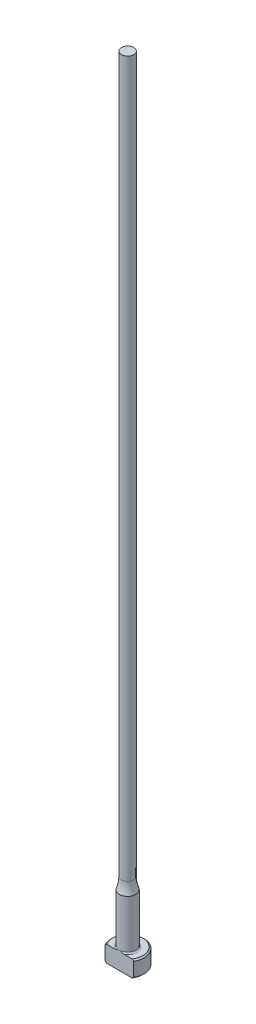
SolidWorks part; units mm, degrees
ref_plane "Front Plane" through (0, 0, 0) normal (0, 0, 1) x (1, 0, 0)
ref_plane "Top Plane" through (0, 0, 0) normal (0, 1, 0) x (1, 0, 0)
ref_plane "Right Plane" through (0, 0, 0) normal (1, 0, 0) x (0, 0, -1)
sketch "Sketch1" plane through (0, 0, 0) normal (0, 0, 1) x (1, 0, 0)
  line L0 (0, 259.9588) -> (0, -15.1925) construction
  line L1 (0, 0) -> (-3.175, 0)
  line L2 (-3.175, 0) -> (-3.175, 3.175)
  line L3 (-3.175, 3.175) -> (-1.5875, 3.175)
  line L4 (-1.19, 14.9114) -> (-1.19, 152.4)
  line L5 (-1.19, 152.4) -> (0, 152.4)
  line L6 (0, 152.4) -> (0, 0)
  line L7 (-1.5875, 3.175) -> (-1.5875, 12.7)
  arc A0 (-1.5875, 12.7) -> (-1.19, 14.9114) centre (-7.54, 14.9114) ccw
  point P13 (-1.5875, 0)
  dimension "D1" = 6.35
  dimension "L" = 152.4
  dimension "D2" = 3.175
  dimension "H" = 6.35
  dimension "T" = 3.175
  dimension "D" = 2.38
  dimension "S" = 12.7
revolve "Revolve1" add sketch "Sketch1" angle 360 about L0
chamfer "Chamfer1" distance 0.254 angle 45 2 edges at (0, 3.175, 3.175) (0, 0, 3.175)
fillet "Fillet1" radius 0.254 1 edges at (0, 3.175, 1.5875)
sketch "Sketch2" plane through (0, 0, 0) normal (0, -1, 0) x (1, 0, 0)
  line L0 (-2.7496, 1.5875) -> (2.7496, 1.5875)
  circle A0 centre (0, 0) radius 3.175 construction
  arc A1 (2.7496, 1.5875) -> (-2.7496, 1.5875) centre (0, 0) ccw
  circle A4 centre (0, 0) radius 1.5875 construction
  dimension "D1" = 0
extrude "KEY" cut sketch "Sketch2" against normal through all
